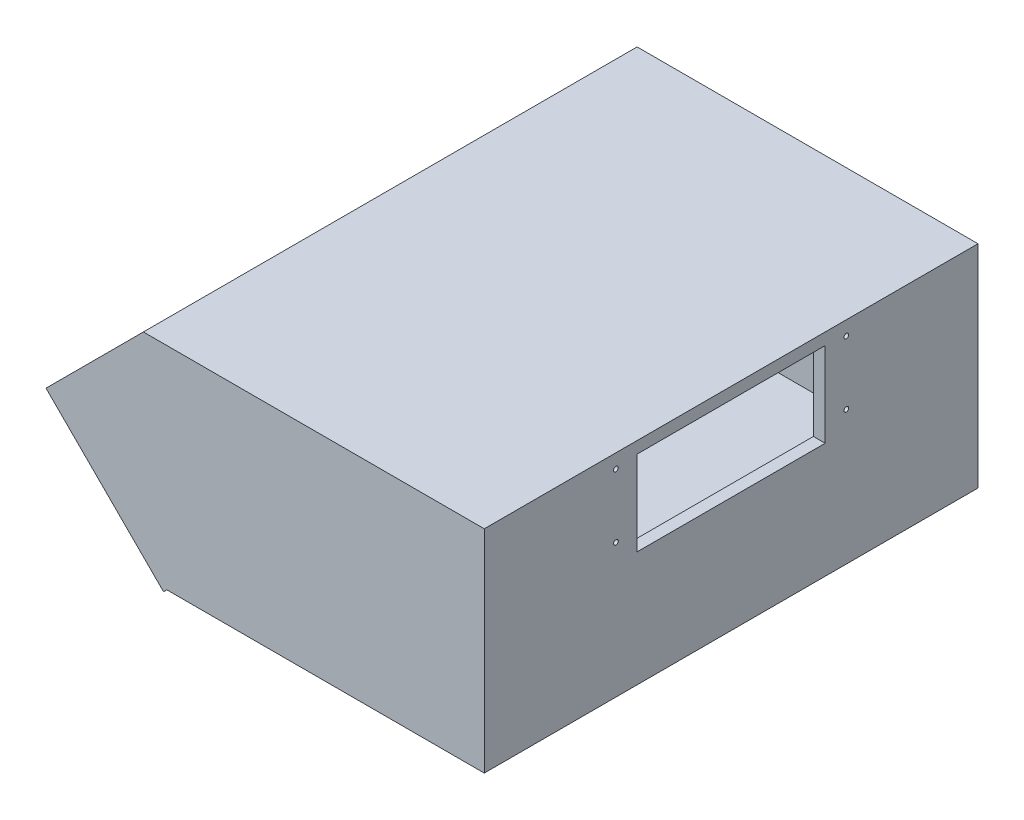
SolidWorks part; units mm, degrees
ref_plane "前视基准面" through (0, 0, 0) normal (0, 0, 1) x (1, 0, 0)
ref_plane "上视基准面" through (0, 0, 0) normal (0, 1, 0) x (1, 0, 0)
ref_plane "右视基准面" through (0, 0, 0) normal (1, 0, 0) x (0, 0, -1)
sketch "草图2" plane through (0, 0, 0) normal (1, 0, 0) x (0, 0, -1)
  line L1 (-95.625, 92.6257) -> (114.375, 92.6257)
  line L2 (-95.625, 92.6257) -> (-95.625, 2.6257)
  line L3 (-95.625, 2.6257) -> (114.375, 2.6257)
  line L4 (114.375, 92.6257) -> (114.375, 2.6257)
  line L5 (-90.625, 87.6257) -> (109.375, 87.6257)
  line L6 (-90.625, 87.6257) -> (-90.625, 7.6257)
  line L7 (-90.625, 7.6257) -> (109.375, 7.6257)
  line L8 (109.375, 87.6257) -> (109.375, 7.6257)
  dimension "D1" = 5
  dimension "D2" = 5
  dimension "D3" = 5
  dimension "D4" = 5
  dimension "D5" = 200
  dimension "D6" = 80
extrude "凸台-拉伸1" add sketch "草图2" along normal blind 180
sketch "草图3" plane through (180, 0, 0) normal (1, 0, 0) x (0, 0, -1)
  line L1 (-95.625, 92.6257) -> (114.375, 92.6257)
  line L2 (-95.625, 92.6257) -> (-95.625, 2.6257)
  line L3 (-95.625, 2.6257) -> (114.375, 2.6257)
  line L4 (114.375, 92.6257) -> (114.375, 2.6257)
extrude "凸台-拉伸2" add sketch "草图3" along normal blind 5
sketch "草图4" plane through (185, 0, 0) normal (1, 0, 0) x (0, 0, -1)
  line L0 (114.375, 92.6257) -> (-95.625, 92.6257) construction
  line L1 (-30.625, 87.6257) -> (49.375, 87.6257)
  line L2 (-30.625, 87.6257) -> (-30.625, 51.6257)
  line L3 (-30.625, 51.6257) -> (49.375, 51.6257)
  line L4 (49.375, 87.6257) -> (49.375, 51.6257)
  line L5 (114.375, 2.6257) -> (114.375, 92.6257) construction
  dimension "D1" = 5
  dimension "D2" = 80
  dimension "D3" = 65
  dimension "D4" = 36
extrude "切除-拉伸1" cut sketch "草图4" against normal up to next
sketch "草图9" plane through (0, 0, 95.625) normal (0, 0, 1) x (1, 0, 0)
  line L0 (40, 92.6257) -> (0, 52.6257)
  line L1 (185, 92.6257) -> (0, 92.6257) construction
  line L2 (0, 92.6257) -> (0, 2.6257) construction
  line L3 (0, 52.6257) -> (0, 92.6257)
  line L4 (0, 92.6257) -> (40, 92.6257)
  line L5 (0, 52.6257) -> (50, 2.6257)
  line L6 (185, 2.6257) -> (0, 2.6257) construction
  line L7 (50, 2.6257) -> (0, 2.6257)
  line L8 (0, 2.6257) -> (0, 52.6257)
  dimension "D1" = 45
  dimension "D2" = 40
  dimension "D3" = 45
extrude "切除-拉伸6" cut sketch "草图9" against normal up to surface (210 mm away) contours L0 M8 M5 | L5 M5 M6
sketch "草图10" plane through (-26.3128, 26.3128, 0) normal (-0.7071, 0.7071, 0) x (0, 0, 1)
  line L1 (-114.375, 93.7805) -> (95.625, 93.7805)
  line L2 (-114.375, 93.7805) -> (-114.375, 37.212)
  line L3 (-114.375, 37.212) -> (95.625, 37.212)
  line L4 (95.625, 93.7805) -> (95.625, 37.212)
extrude "凸台-拉伸5" add sketch "草图10" against normal blind 5
sketch "草图11" plane through (26.3128, 26.3128, 0) normal (-0.7071, -0.7071, 0) x (0, 0, 1)
  line L1 (95.625, 37.212) -> (-114.375, 37.212)
  line L2 (95.625, 37.212) -> (95.625, -33.4987)
  line L3 (95.625, -33.4987) -> (-114.375, -33.4987)
  line L4 (-114.375, 37.212) -> (-114.375, -33.4987)
  line L5 (90.625, 32.212) -> (-110.6795, 32.212)
  line L6 (90.625, 32.212) -> (90.625, -28.4987)
  line L7 (90.625, -28.4987) -> (-110.6795, -28.4987)
  line L8 (-110.6795, 32.212) -> (-110.6795, -28.4987)
  dimension "D1" = 5
extrude "凸台-拉伸6" add sketch "草图11" along normal blind 2
fillet "圆角1" radius 5 1 edges at (45, 7.6257, -9.375)
sketch "草图13" plane through (185, 0, 0) normal (1, 0, 0) x (0, 0, -1)
  line L0 (114.375, 92.6257) -> (-95.625, 92.6257) construction
  line L1 (49.375, 51.6257) -> (49.375, 87.6257) construction
  circle A0 centre (58.375, 86.6257) radius 1
  circle A1 centre (-39.625, 86.6257) radius 1
  circle A2 centre (-39.625, 59.6257) radius 1
  circle A3 centre (58.375, 59.6257) radius 1
  dimension "D1" = 6
  dimension "D2" = 27
  dimension "D3" = 6
  dimension "D4" = 27
  dimension "D5" = 98
  dimension "D7" = 2
  dimension "D8" = 2
  dimension "D9" = 2
  dimension "D10" = 2
  dimension "D6" = 98
  dimension "D11" = 9
extrude "切除-拉伸12" cut sketch "草图13" against normal up to next
